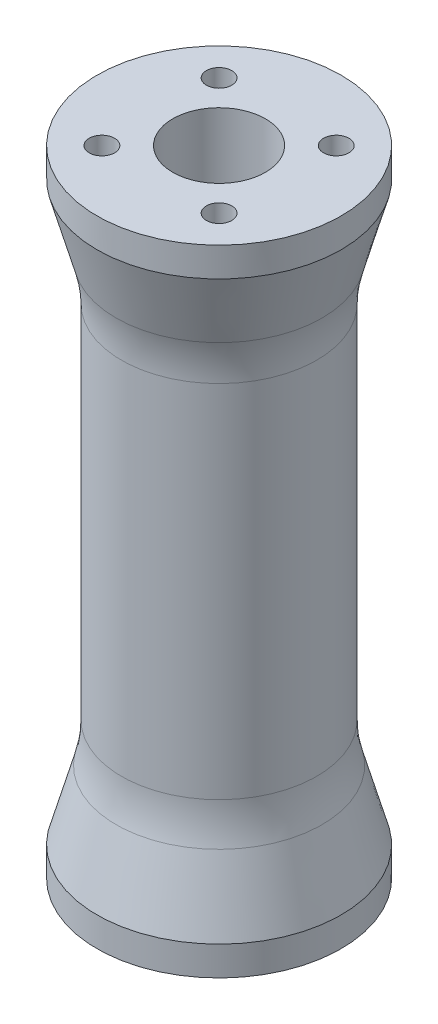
SolidWorks part; units mm, degrees
ref_plane "Front Plane" through (0, 0, 0) normal (0, 0, 1) x (1, 0, 0)
ref_plane "Top Plane" through (0, 0, 0) normal (0, 1, 0) x (1, 0, 0)
ref_plane "Right Plane" through (0, 0, 0) normal (1, 0, 0) x (0, 0, -1)
sketch "Sketch1" plane through (0, 0, 0) normal (0, 0, 1) x (1, 0, 0)
  line L0 (0, -32.5) -> (0, 32.5)
  line L1 (0, 32.5) -> (-12.5, 32.5)
  line L2 (-12.5, 32.5) -> (-12.5, 29.5)
  line L3 (-12.5, 29.5) -> (-10, 20.5)
  line L4 (-10, 20.5) -> (-10, -20.5)
  line L5 (-10, 0) -> (0, 0) construction
  line L6 (-12.5, -29.5) -> (-10, -20.5)
  line L7 (-12.5, -32.5) -> (-12.5, -29.5)
  line L8 (0, -32.5) -> (-12.5, -32.5)
  dimension "D1" = 12.5
  dimension "D2" = 3
  dimension "D3" = 10
  dimension "D4" = 65
  dimension "D5" = 12
revolve "Revolve1" add sketch "Sketch1" angle 360 about L0
sketch "Sketch2" plane through (0, 32.5, 0) normal (0, 1, 0) x (1, 0, 0)
  line L1 (6, -6) -> (-6, -6) construction
  line L2 (6, -6) -> (6, 6) construction
  line L3 (6, 6) -> (-6, 6) construction
  line L4 (-6, -6) -> (-6, 6) construction
  line L5 (6, -6) -> (-6, 6) construction
  line L6 (6, 6) -> (-6, -6) construction
  circle A0 centre (-6, 6) radius 1.3
  circle A1 centre (6, 6) radius 1.3
  circle A2 centre (-6, -6) radius 1.3
  circle A3 centre (6, -6) radius 1.3
  point P0 (0, 0)
  dimension "D1" = 12
  dimension "D2" = 2.6
extrude "Cut-Extrude1" cut sketch "Sketch2" against normal blind 7
mirror "Mirror1" about plane through (0, 0, 0) normal (0, 1, 0) of "Cut-Extrude1"
sketch "Sketch4" plane through (0, 0, 0) normal (0, 0, 1) x (1, 0, 0)
  line L0 (0, 29.7) -> (-9, 20.7)
  line L1 (0, -32.5) -> (0, 32.5) construction
  line L2 (10, 20.5) -> (-10, 20.5) construction
  line L3 (-9, 20.7) -> (-9, -20.7)
  line L4 (-10, 0) -> (0, 0) construction
  line L5 (0, 29.7) -> (0, -29.7)
  line L6 (0, 0) -> (-9, 0) construction
  line L7 (0, -29.7) -> (-9, -20.7)
  line L8 (-4.7, 25.5) -> (-4.7, 25) construction
  line L9 (-10, 20.5) -> (-10, -20.5) construction
  line L10 (-4.7, 25.5) -> (-7.3, 25.5) construction
  line L11 (-4.7, 25.5) -> (-4.7, 32.5) construction
  dimension "D1" = 45
  dimension "D2" = 1
  dimension "D3" = 0.5
revolve "Cut-Revolve1" cut sketch "Sketch4" angle 360 about L5
sketch "Sketch5" plane through (0, 32.5, 0) normal (0, 1, 0) x (1, 0, 0)
  circle A0 centre (0, 0) radius 4.75
  dimension "D1" = 9.5
extrude "Cut-Extrude2" cut sketch "Sketch5" against normal through all
fillet "Fillet1" radius 15 2 edges at (0, -20.5, -10) (0, 20.5, -10)
fillet "Fillet2" radius 4 2 edges at (-9, -20.7, 0) (-9, 20.7, 0)
